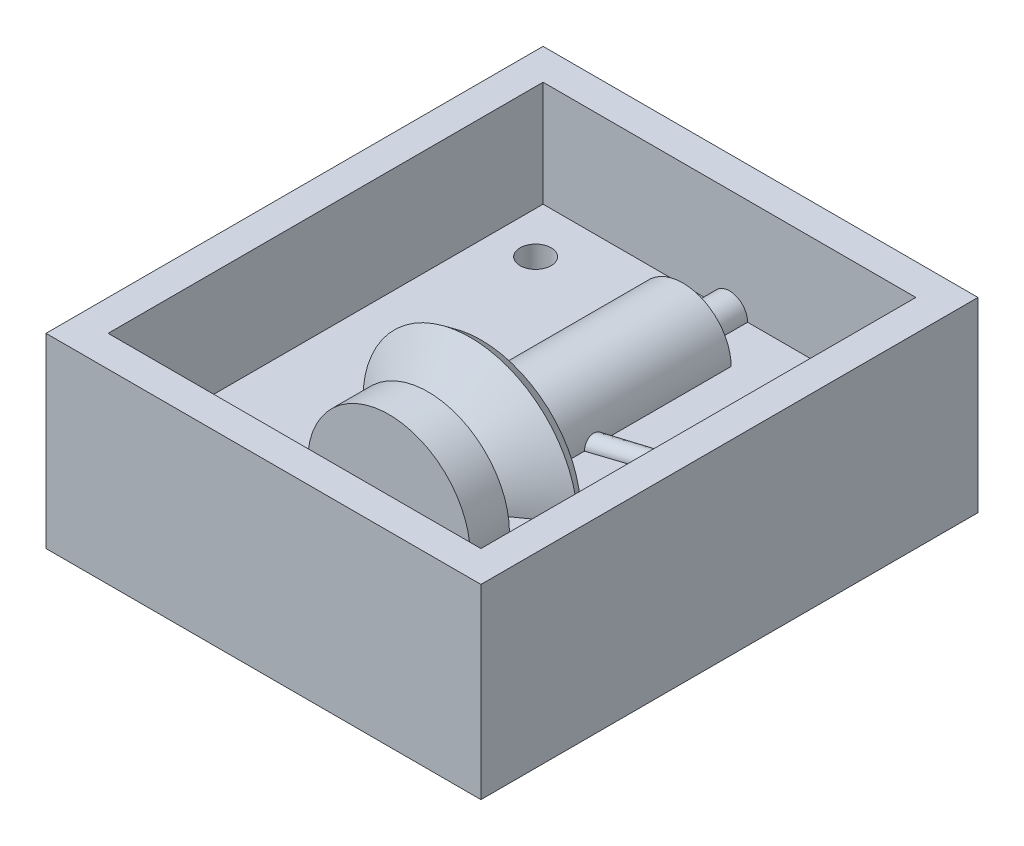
SolidWorks part; units mm, degrees
ref_plane "Front Plane" through (0, 0, 0) normal (0, 0, 1) x (1, 0, 0)
ref_plane "Top Plane" through (0, 0, 0) normal (0, 1, 0) x (1, 0, 0)
ref_plane "Right Plane" through (0, 0, 0) normal (1, 0, 0) x (0, 0, -1)
sketch "Sketch2" plane through (0, 0, 0) normal (0, 1, 0) x (1, 0, 0)
  line L1 (35, -40) -> (-35, -40)
  line L2 (35, -40) -> (35, 40)
  line L3 (35, 40) -> (-35, 40)
  line L4 (-35, -40) -> (-35, 40)
  line L5 (35, -40) -> (-35, 40) construction
  line L6 (35, 40) -> (-35, -40) construction
  point P0 (0, 0)
  dimension "D1" = 70
  dimension "D2" = 80
extrude "Boss-Extrude1" add sketch "Sketch2" along normal blind 30
sketch "Sketch3" plane through (0, 30, 0) normal (0, 1, 0) x (1, 0, 0)
  line L1 (30, -35) -> (-30, -35)
  line L2 (30, -35) -> (30, 35)
  line L3 (30, 35) -> (-30, 35)
  line L4 (-30, -35) -> (-30, 35)
  line L5 (30, -35) -> (-30, 35) construction
  line L6 (30, 35) -> (-30, -35) construction
  point P0 (0, 0)
  dimension "D1" = 60
  dimension "D2" = 70
extrude "Cut-Extrude1" cut sketch "Sketch3" against normal blind 17
sketch "Sketch6" plane through (0, 13, 0) normal (0, 1, 0) x (1, 0, 0)
  line L0 (0, 41.7837) -> (0, -42.107) construction
  line L1 (0, 35) -> (0, -19.8008)
  line L2 (30, 35) -> (-30, 35) construction
  line L3 (0, -19.8008) -> (13.0928, -19.8008)
  line L4 (13.0928, -19.8008) -> (13.0928, -13.4969)
  line L5 (13.0928, -13.4969) -> (7.7587, -13.4969)
  line L6 (7.7587, -13.4969) -> (17.2954, -6.708)
  line L7 (17.2954, -6.708) -> (16.0571, -4.9685)
  line L8 (16.0571, -4.9685) -> (7.7587, -10.8759)
  line L9 (7.7587, -10.8759) -> (7.7587, 27.5106)
  line L10 (7.7587, 27.5106) -> (2.9191, 27.5106)
  line L11 (2.9191, 27.5106) -> (2.9191, 35)
  line L12 (30, 35) -> (-30, 35) construction
  line L13 (2.9191, 35) -> (0, 35)
revolve "Revolve2" add sketch "Sketch6" angle 360 about L0
sketch "Sketch8" plane through (0, 13, 0) normal (0, 1, 0) x (1, 0, 0)
  line L0 (7.7587, 5.5766) -> (30, 12.6887) construction
  line L1 (7.7587, 27.5106) -> (7.7587, -10.8759) construction
  line L2 (30, -35) -> (30, 35) construction
  line L3 (7.7587, 5.5766) -> (7.7587, 3.9023)
  line L4 (7.7587, 3.9023) -> (30.84, 11.446)
  line L5 (30.84, 11.446) -> (30, 12.6887)
  line L6 (7.7587, 5.5766) -> (30, 12.6887)
  dimension "D1" = 1.5
revolve "Revolve3" add sketch "Sketch8" angle 360 about L0
sketch "Sketch9" plane through (0, 13, 0) normal (0, 1, 0) x (1, 0, 0)
  line L1 (35, 40) -> (-35, 40) construction
  line L2 (-35, -40) -> (35, -40) construction
  line L4 (0, 40) -> (0, -40) construction
  line L5 (-35, 0) -> (35, 0) construction
  line L6 (-35, 40) -> (-35, -40) construction
  line L7 (35, -40) -> (35, 40) construction
  circle A0 centre (-23.276, 27.0746) radius 2.5
  circle A1 centre (23.276, 27.0746) radius 2.5
  circle A2 centre (-23.276, -27.0746) radius 2.5
  circle A3 centre (23.276, -27.0746) radius 2.5
  dimension "D1" = 5
extrude "Cut-Extrude2" cut sketch "Sketch9" against normal blind 8
